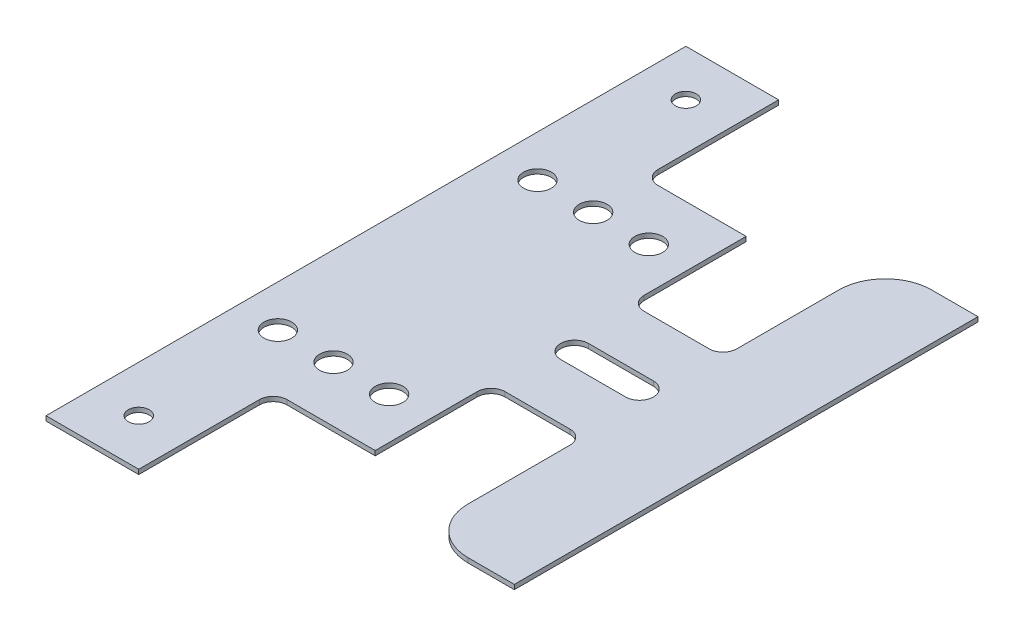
SolidWorks part; units mm, degrees
ref_plane "Front Plane" through (0, 0, 0) normal (0, 0, 1) x (1, 0, 0)
ref_plane "Top Plane" through (0, 0, 0) normal (0, 1, 0) x (1, 0, 0)
ref_plane "Right Plane" through (0, 0, 0) normal (1, 0, 0) x (0, 0, -1)
sketch "Sketch1" plane through (0, 0, 0) normal (0, 1, 0) x (1, 0, 0)
  line L0 (0, 0) -> (82, 0) construction
  line L1 (0, -69) -> (0, 69)
  line L2 (0, 69) -> (20, 69)
  line L3 (20, 69) -> (20, 43)
  line L4 (23, 40) -> (42, 40)
  line L5 (42, 40) -> (42, 18)
  line L6 (45, 15) -> (59, 15)
  line L7 (62, 18) -> (62, 40)
  line L8 (72, 50) -> (82, 50)
  line L9 (82, 50) -> (82, -50)
  line L10 (59, 3) -> (45, 3)
  line L11 (45, -3) -> (59, -3)
  line L12 (0, -69) -> (20, -69)
  line L13 (20, -69) -> (20, -43)
  line L14 (23, -40) -> (42, -40)
  line L15 (42, -40) -> (42, -18)
  line L16 (45, -15) -> (59, -15)
  line L17 (62, -18) -> (62, -40)
  line L18 (72, -50) -> (82, -50)
  arc A0 (62, 40) -> (72, 50) centre (72, 40) cw
  arc A1 (59, -3) -> (59, 3) centre (59, 0) ccw
  arc A2 (45, 3) -> (45, -3) centre (45, 0) ccw
  circle A3 centre (10, 59) radius 2.25
  circle A4 centre (9, 28) radius 3
  circle A5 centre (21, 28) radius 3
  circle A6 centre (33, 28) radius 3
  arc A7 (45, 15) -> (42, 18) centre (45, 18) cw
  arc A8 (59, 15) -> (62, 18) centre (59, 18) ccw
  arc A9 (23, 40) -> (20, 43) centre (23, 43) cw
  circle A10 centre (33, -28) radius 3
  circle A11 centre (21, -28) radius 3
  circle A12 centre (9, -28) radius 3
  circle A13 centre (10, -59) radius 2.25
  arc A14 (23, -40) -> (20, -43) centre (23, -43) ccw
  arc A15 (45, -15) -> (42, -18) centre (45, -18) ccw
  arc A16 (59, -15) -> (62, -18) centre (59, -18) cw
  arc A17 (62, -40) -> (72, -50) centre (72, -40) ccw
  point P13 (62, 50)
  point P30 (42, 15)
  dimension "D9" = 10
  dimension "D10" = 6
  dimension "D11" = 23
  dimension "D12" = 14
  dimension "D13" = 4.5
  dimension "D14" = 10
  dimension "D15" = 10
  dimension "D16" = 6
  dimension "D17" = 9
  dimension "D18" = 12
  dimension "D19" = 12
  dimension "D20" = 28
  dimension "D21" = 28
  dimension "D22" = 28
  dimension "D23" = 3
  dimension "D1" = 82
  dimension "D2" = 69
  dimension "D3" = 20
  dimension "D4" = 25
  dimension "D5" = 15
  dimension "D6" = 50
  dimension "D7" = 20
  dimension "D8" = 42
sheet metal parameters "Sheet-Metal1" thickness 1 parameters "D1"=0.0001
base flange "Base-Flange1" sketch "Sketch1" thickness 1 reverse thickness direction yes parameters "D1"=0.0001
flat pattern "Flat-Pattern1"
sketch "Bend-Lines1" plane through (0, 0, 0) normal (0, 1, 0) x (-1, 0, 0)
